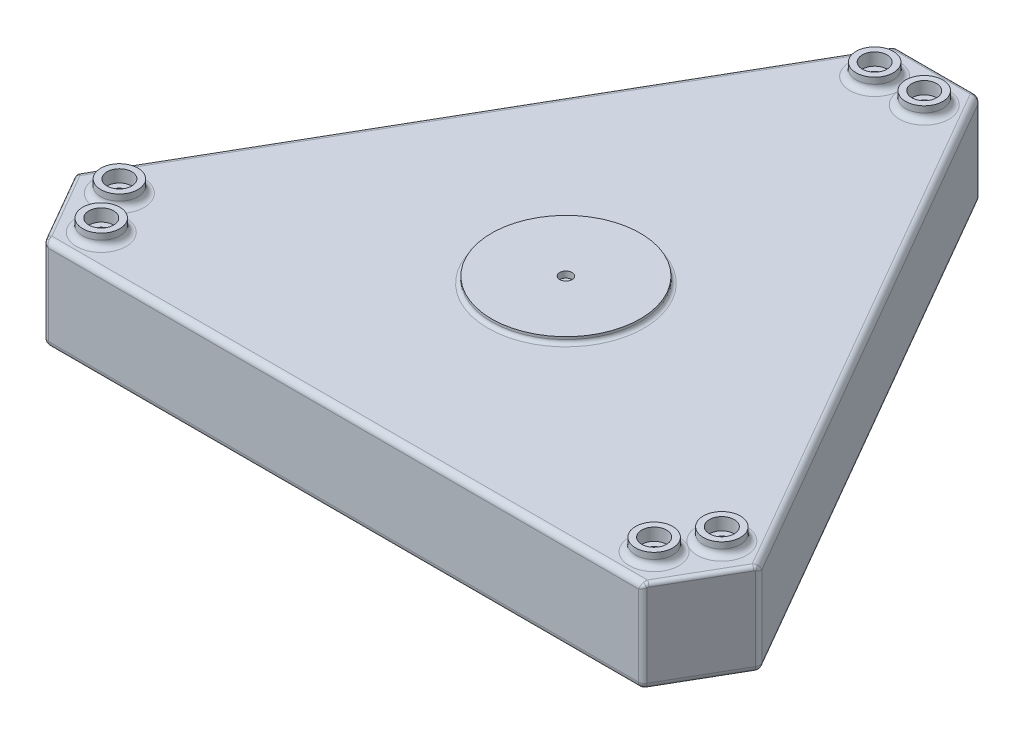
SolidWorks part; units mm, degrees
ref_plane "Plan de face" through (0, 0, 0) normal (0, 0, 1) x (1, 0, 0)
ref_plane "Plan de dessus" through (0, 0, 0) normal (0, 1, 0) x (1, 0, 0)
ref_plane "Plan de droite" through (0, 0, 0) normal (1, 0, 0) x (0, 0, -1)
sketch "Esquisse1" plane through (0, 0, 0) normal (0, 1, 0) x (1, 0, 0)
  line L0 (-311, -179.5559) -> (311, -179.5559)
  line L1 (311, -179.5559) -> (0, 359.1119)
  line L2 (0, 359.1119) -> (-311, -179.5559)
  point P3 (0, 0)
  point P6 (-413.2339, 248.9869)
  dimension "D1" = 622
  dimension "D2" = 622
  dimension "D3" = 622
  dimension "D4" = 179.5559
  dimension "D5" = 179.5559
extrude "Boss.-Extru.1" add sketch "Esquisse1" along normal blind 75
chamfer "Chanfrein1" distance 70 3 edges at (-311, 37.5, 179.5559) (311, 37.5, 179.5559) (0, 37.5, -359.1119)
fillet "Congé1" radius 5 15 edges at (0, 0, -298.4901) (-155.5, 0, -89.778) (-258.5, 0, 149.245) (0, 0, 179.5559) (258.5, 0, 149.245) (155.5, 0, -89.778) (-241, 37.5, 179.5559) (0, 75, 179.5559) (241, 37.5, 179.5559) (35, 37.5, -298.4901) (276, 37.5, 118.9342) (155.5, 75, -89.778) (-276, 37.5, 118.9342) (-35, 37.5, -298.4901) (-155.5, 75, -89.778)
sketch "Esquisse2" plane through (0, 75, 0) normal (0, 1, 0) x (1, 0, 0)
  circle A0 centre (0, 0) radius 60
  circle A1 centre (0, 0) radius 5
  dimension "D1" = 120
  dimension "D2" = 10
extrude "Boss.-Extru.2" add sketch "Esquisse2" along normal blind 5
fillet "Congé2" radius 3 16 edges at (34.6132, 72.5, -297.8202) (30.7208, 74.8296, -298.4901) (-34.6132, 72.5, -297.8202) (-30.7208, 74.8296, -298.4901) (240.6132, 72.5, 178.8861) (243.1396, 74.8296, 175.85) (275.2265, 72.5, 118.9342) (273.8604, 74.8296, 122.6401) (-275.2265, 72.5, 118.9342) (-273.8604, 74.8296, 122.6401) (-240.6132, 72.5, 178.8861) (-243.1396, 74.8296, 175.85) (0, 75, 60) (0, 75, -298.4901) (258.5, 75, 149.245) (-258.5, 75, 149.245)
sketch "Esquisse3" plane through (0, 75, 0) normal (0, 1, 0) x (1, 0, 0)
  line L0 (0, 0) -> (-258.5, -149.245) construction
  line L1 (-243.0207, -176.0559) -> (-273.9793, -122.4342) construction
  line L2 (-223.1845, -151.9496) -> (0, 0) construction
  circle A0 centre (-223.1845, -151.9496) radius 15
  dimension "D1" = 30
  dimension "D2" = 20
  dimension "D3" = 270
extrude "Boss.-Extru.3" add sketch "Esquisse3" along normal blind 10
ref_plane "Plan1" through (0, 75, 0) normal (0, 1, 0) x (-1, 0, 0)
ref_plane "Plan2" through (-223.18, 0, 0) normal (1, 0, 0) x (0, 0, -1)
sketch "Esquisse5" plane through (-223.18, 0, 0) normal (1, 0, 0) x (0, 0, -1)
  line L0 (-151.9496, 78.5188) -> (-151.9496, 101.1484) construction
  line L1 (-151.9496, 85) -> (-151.9496, 75) construction
  line L2 (16.5, 75) -> (-16.5, 75) construction
  line L3 (-146.9496, 75) -> (-146.9496, 85)
  line L4 (-136.9496, 85) -> (-166.9496, 85) construction
  line L5 (-146.9496, 85) -> (-151.9496, 85)
  line L6 (-151.9496, 70) -> (-151.9496, 85)
  arc A0 (-146.9496, 75) -> (-151.9496, 70) centre (-151.9496, 75) cw
  dimension "D1" = 5
revolve "Enlèvement de matière-Révolution3" cut sketch "Esquisse5" angle 360 about L0
sketch "Esquisse7" plane through (0, 85, 0) normal (0, 1, 0) x (1, 0, 0)
  circle A0 centre (-223.18, -151.9496) radius 10
  dimension "D1" = 20
extrude "Enlèv. mat.-Extru.1" cut sketch "Esquisse7" against normal blind 10
fillet "Congé3" radius 5 1 edges at (-223.1845, 75, 166.9496)
pattern_circular "Répétition circulaire1" count 2 over 8.5 about axis through (0, 80, 0) along (0, -1, 0) of "Boss.-Extru.3", "Enlèvement de matière-Révolution3", "Congé3", "Enlèv. mat.-Extru.1"
pattern_circular "Répétition circulaire5" count 3 over 360 about axis through (0, 0, 0) along (0, 1, 0) of "Boss.-Extru.3", "Enlèvement de matière-Révolution3", "Enlèv. mat.-Extru.1", "Congé3", "Répétition circulaire1"
